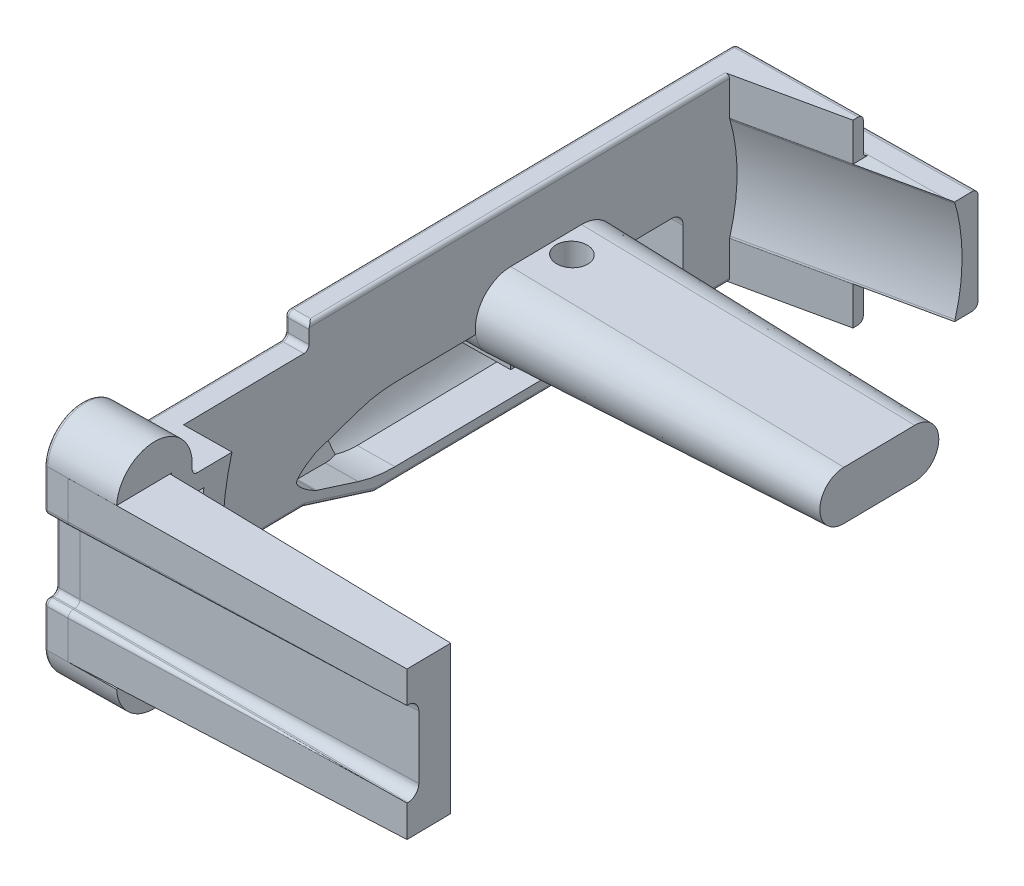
SolidWorks part; units mm, degrees
ref_plane "Front Plane" through (0, 0, 0) normal (0, 0, 1) x (1, 0, 0)
ref_plane "Top Plane" through (0, 0, 0) normal (0, 1, 0) x (1, 0, 0)
ref_plane "Right Plane" through (0, 0, 0) normal (1, 0, 0) x (0, 0, -1)
body saved out of another part "Stock-MAGAZIN-1"
